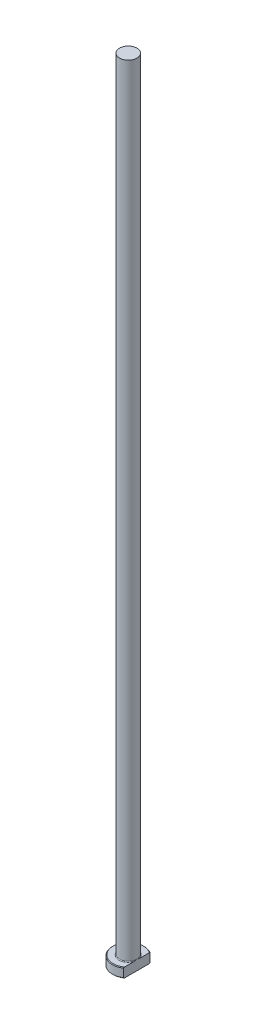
SolidWorks part; units mm, degrees
ref_plane "Front Plane" through (0, 0, 0) normal (0, 0, 1) x (1, 0, 0)
ref_plane "Top Plane" through (0, 0, 0) normal (0, 1, 0) x (1, 0, 0)
ref_plane "Right Plane" through (0, 0, 0) normal (1, 0, 0) x (0, 0, -1)
sketch "Sketch1" plane through (0, 0, 0) normal (0, 0, 1) x (1, 0, 0)
  line L0 (0, 259.9588) -> (0, -15.1925) construction
  line L1 (0, 0) -> (-5, 0)
  line L2 (-5, 0) -> (-5, 3)
  line L3 (-5, 3) -> (-2.75, 3)
  line L4 (-2.75, 3) -> (-2.75, 250)
  line L5 (-2.75, 250) -> (0, 250)
  line L6 (0, 250) -> (0, 0)
  dimension "L" = 250
  dimension "H" = 10
  dimension "T" = 3
  dimension "D" = 5.5
revolve "Revolve1" add sketch "Sketch1" angle 360 about L0
chamfer "Chamfer1" distance 0.2 angle 45 2 edges at (0, 3, 5) (0, 0, 5)
fillet "Fillet1" radius 0.2 1 edges at (0, 3, 2.75)
sketch "Sketch2" plane through (0, 0, 0) normal (0, 1, 0) x (1, 0, 0)
  line L0 (2.75, 4.1758) -> (2.75, -4.1758)
  circle A0 centre (0, 0) radius 5 construction
  arc A1 (2.75, -4.1758) -> (2.75, 4.1758) centre (0, 0) ccw
  circle A2 centre (0, 0) radius 2.75 construction
extrude "KEY" cut sketch "Sketch2" along normal through all
